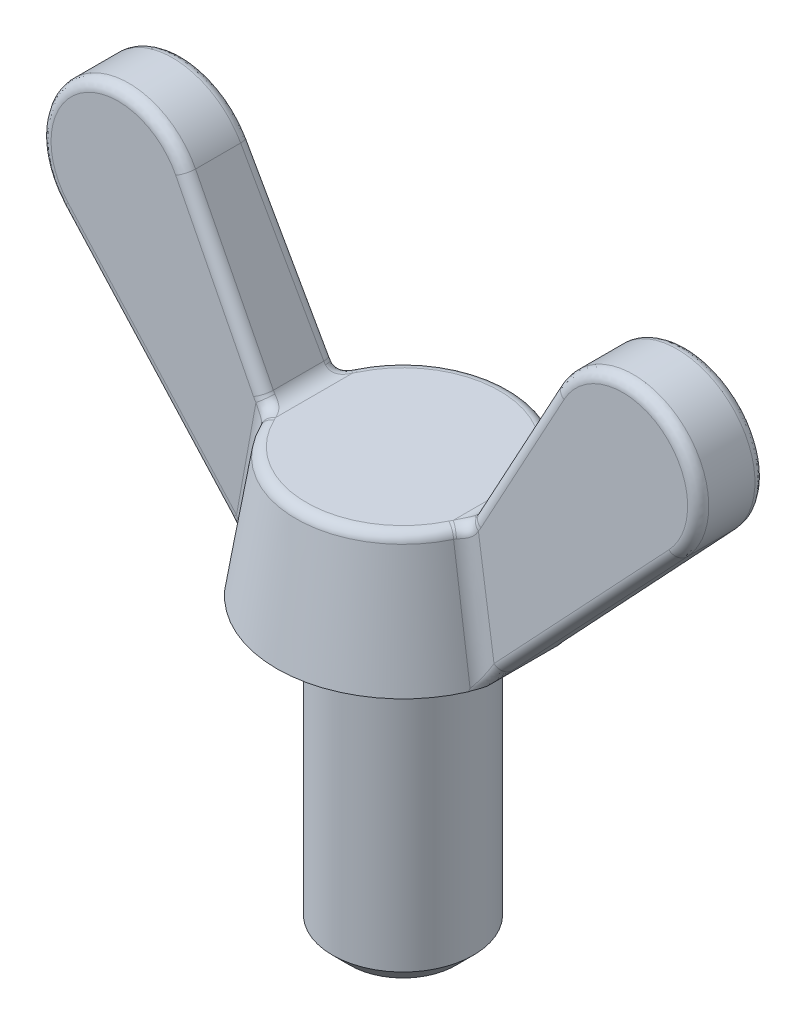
SolidWorks part; units mm, degrees
ref_plane "Front Plane" through (0, 0, 0) normal (0, 0, 1) x (1, 0, 0)
ref_plane "Top Plane" through (0, 0, 0) normal (0, 1, 0) x (1, 0, 0)
ref_plane "Right Plane" through (0, 0, 0) normal (1, 0, 0) x (0, 0, -1)
sketch "HeadSke" plane through (0, 0, 0) normal (0, 0, 1) x (1, 0, 0)
  line L0 (0, 0) -> (-21.5, 0)
  line L1 (-21.5, 0) -> (-18, 22)
  line L2 (-18, 22) -> (0, 22)
  line L3 (0, 22) -> (0, 0)
  line L4 (0, -38.5148) -> (0, 38.5148) construction
  dimension "Top_Width" = 36
  dimension "Bottom_Width" = 43
  dimension "Head_Height" = 22
revolve "Head" add sketch "HeadSke" angle 360 about L4
sketch "BaseWingSke" plane through (0, 0, 0) normal (1, 0, 0) x (0, 0, -1)
  line L0 (0, 0) -> (0, 62.8635) construction
  line L1 (-5.5, 56) -> (-6.5, 0)
  line L2 (-5.5, 56) -> (5.5, 56)
  line L3 (5.5, 56) -> (6.5, 0)
  line L4 (6.5, 0) -> (-6.5, 0)
  point P8 (0, 56)
  dimension "TopWing_Width" = 11
  dimension "BottomWing_Width" = 13
  dimension "Height" = 56
extrude "BaseWing" add sketch "BaseWingSke" along normal mid plane 112
sketch "CutWingSke" plane through (0, 0, 0) normal (0, 0, 1) x (1, 0, 0)
  line L0 (0, 0) -> (0, 84.5075) construction
  line L1 (-20.4939, 0) -> (-52.4668, 34.043)
  line L2 (-16.9323, 22) -> (-31.4795, 49.126)
  line L3 (56, 56) -> (-56, 56) construction
  line L4 (-56, 56) -> (-56, 0) construction
  line L5 (-16.9323, 22) -> (16.9323, 22)
  line L6 (-20.4939, 0) -> (20.4939, 0)
  line L7 (20.4939, 0) -> (52.4668, 34.043)
  line L8 (16.9323, 22) -> (31.4795, 49.126)
  line L9 (-20.4939, 0) -> (-56, 0) construction
  line L10 (-66, 66) -> (66, 66)
  line L11 (-66, 66) -> (-66, -10)
  line L12 (-66, -10) -> (66, -10)
  line L13 (66, 66) -> (66, -10)
  line L14 (56, 56) -> (56, 0) construction
  arc A0 (-31.4795, 49.126) -> (-52.4668, 34.043) centre (-42.966, 42.966) ccw
  arc A1 (31.4795, 49.126) -> (52.4668, 34.043) centre (42.966, 42.966) cw
  dimension "D1" = 10
  dimension "Wing_ang" = 15
  dimension "D2" = 10
  dimension "D3" = 10
  dimension "D4" = 10
extrude "CutWing" cut sketch "CutWingSke" against normal mid plane 112
fillet "Fillet1" radius 3 6 edges at (-16.9323, 22, 0) (16.9323, 22, 0)
fillet "Fillet2" radius 1.8 30 edges at (-21.4266, 0.9931, 6.6579) (-37.3823, 17.9819, 6.1789) (-50.5726, 53.5502, 5.5437) (-24.9759, 36.9987, 5.8393) (-17.1926, 22.8149, 6.5578) (0, 22, -18) (0, 22, 18) (16.7923, 22.498, 6.9107) (24.9759, 36.9987, 5.8393) (21.2732, 0.8298, 6.7311) (37.3823, 17.9819, 6.1789) (21.4266, 0.9931, -6.6579) (37.3823, 17.9819, -6.1789) (50.5726, 53.5502, -5.5437) (-21.2732, 0.8298, -6.7311) (-37.3823, 17.9819, -6.1789) (-50.5726, 53.5502, -5.5437) (-24.9759, 36.9987, -5.8393) (-16.7923, 22.498, -6.9107) (17.1926, 22.8149, -6.5578) (50.5726, 53.5502, 5.5437) (24.9759, 36.9987, -5.8393)
sketch "BodySke" plane through (0, 0, 0) normal (0, 0, 1) x (1, 0, 0)
  line L0 (0, 0) -> (0, -98.4281) construction
  line L1 (-10.352, -22.6535) -> (-10.352, -78.0459) construction
  line L2 (0, 0) -> (-12, 0)
  line L3 (0, 0) -> (0, -50)
  line L4 (0, -50) -> (-12, -50)
  line L5 (-12, 0) -> (-12, -50)
  line L6 (9.5285, -48.5) -> (-28.2347, -48.5) construction
  dimension "Diameter" = 24
  dimension "Length" = 50
  dimension "Minor_dia" = 20.704
  dimension "Advance" = 3
revolve "BaseBody" add sketch "BodySke" angle 360 about L0
sketch "ChamferedEndSke" plane through (0, 0, 0) normal (0, 0, 1) x (1, 0, 0)
  line L0 (-12, -47) -> (-12, -50)
  line L1 (-12, -50) -> (-9, -50)
  line L2 (-9, -50) -> (-12, -47)
  line L5 (0, 0) -> (0, -116.5105) construction
  dimension "Ang" = 45
  dimension "Chamfer_width" = 3
revolve "ChamferedEnd" cut sketch "ChamferedEndSke" angle 360 about L5
sketch "CutEndSke" plane through (0, -50, 0) normal (0, -1, 0) x (1, 0, 0)
  circle A0 centre (0, 0) radius 12 construction
  circle A1 centre (0, 0) radius 12
extrude "CutEnd" [suppressed] cut sketch "CutEndSke" against normal blind 3
dome "RoundedEnd" [suppressed] faces to dome 1 distance 3 parameters "D1"=3
sketch "ThdSchSke" plane through (0, 0, 0) normal (0, 0, 1) x (1, 0, 0)
  line L0 (0, 0) -> (0, -154.0819) construction
  line L1 (49.4883, -50) -> (-82.1477, -50) construction
  line L2 (13.9029, -46.4985) -> (12, -46.4985)
  line L3 (12, -46.4985) -> (10.352, -47.45)
  line L4 (10.352, -47.45) -> (12, -48.4015)
  line L5 (12, -48.4015) -> (13.9029, -48.4015)
  line L6 (13.9029, -48.4015) -> (13.9029, -46.4985)
  dimension "D1" = 20.704
  dimension "Length" = 50
  dimension "D2" = 24
  dimension "D3" = 2.55
revolve "ThreadSchematic" [suppressed] cut sketch "ThdSchSke" angle 360 about L0
pattern_linear "ThdSchPat" [suppressed] count 15 along (0, -1, 0)
equation "\"D1@CutWing\" = \"Width@BaseWing\""
equation "\"D1@Fillet1\" =\"Top_Width@HeadSke\"/12"
equation "\"D1@Fillet2\" = \"Top_Width@HeadSke\"/20"
equation "\"Thread_minor@ThreadCosmetic\" = \"Minor_dia@BodySke\""
equation "\"D1@CutEnd\" = \"Chamfer_width@ChamferedEndSke\""
equation "\"D1@RoundedEnd\" = \"Chamfer_width@ChamferedEndSke\""
equation "\"Length@ThdSchSke\" = \"Length@BodySke\""
equation "\"D1@ThdSchSke\" = \"Minor_dia@BodySke\""
equation "\"D2@ThdSchSke\" = \"Diameter@BodySke\""
equation "\"D3@ThdSchSke\" = \"Advance@BodySke\"*0.85"
equation "\"Advance@ThdSchPat\" = \"Advance@BodySke\""
equation "\"D1@ThdSchPat\" =  int( \"Length@BodySke\" / \"Advance@BodySke\" ) -1"
